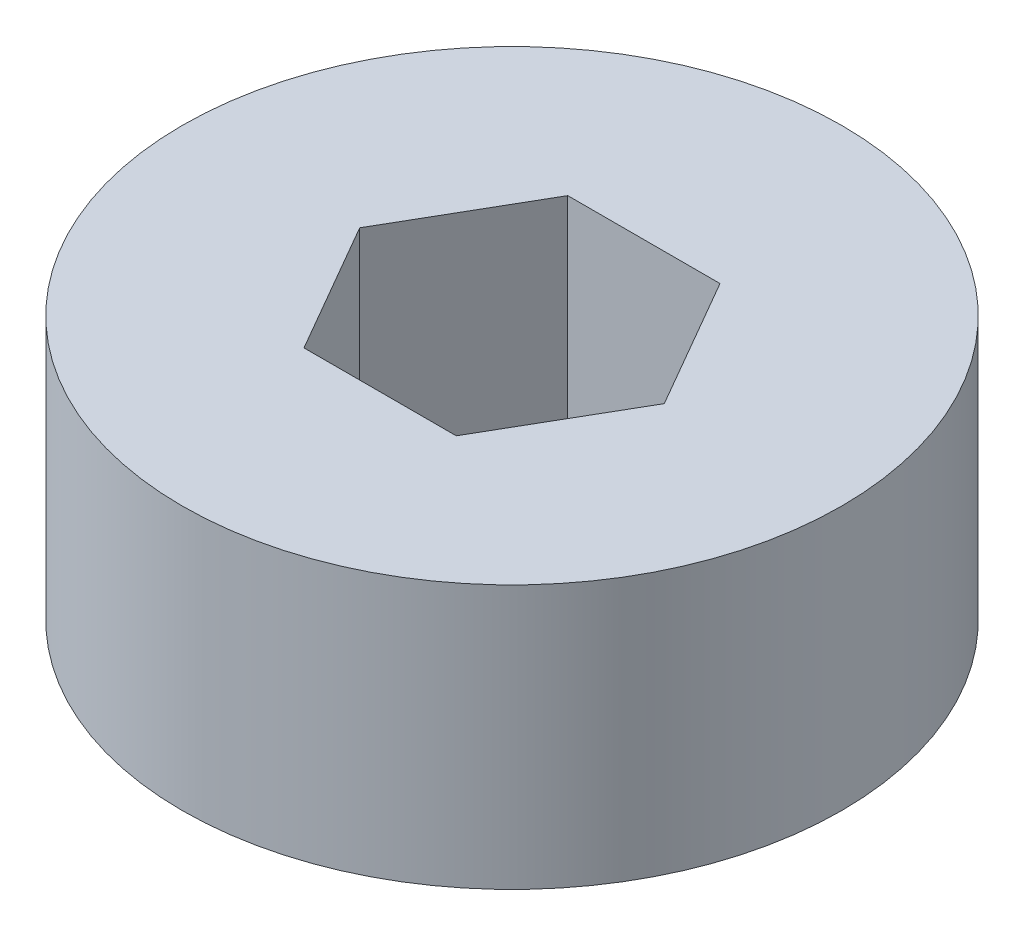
SolidWorks part; units mm, degrees
ref_plane "Plane1" through (0, 0, 0) normal (0, 0, 1) x (1, 0, 0)
ref_plane "Plane2" through (0, 0, 0) normal (0, 1, 0) x (1, 0, 0)
ref_plane "Plane3" through (0, 0, 0) normal (1, 0, 0) x (0, 0, -1)
sketch "Sketch1" plane through (0, 0, 0) normal (0, 1, 0) x (1, 0, 0)
  circle A0 centre (0, 0) radius 12.5
  dimension "D1" = 25
extrude "Base-Extrude" add sketch "Sketch1" along normal blind 10
sketch "Sketch2" plane through (0, 10, 0) normal (0, 1, 0) x (-1, 0, 0)
  line L1 (-5.7735, 0) -> (-2.8868, -5)
  line L2 (-2.8868, -5) -> (2.8868, -5)
  line L3 (2.8868, -5) -> (5.7735, 0)
  line L4 (5.7735, 0) -> (2.8868, 5)
  line L5 (2.8868, 5) -> (-2.8868, 5)
  line L6 (-2.8868, 5) -> (-5.7735, 0)
  circle A0 centre (0, 0) radius 5 construction
  circle A1 centre (0, 0) radius 12.5 construction
  dimension "Across_Flats" = 10
extrude "Hex" cut sketch "Sketch2" against normal through all
